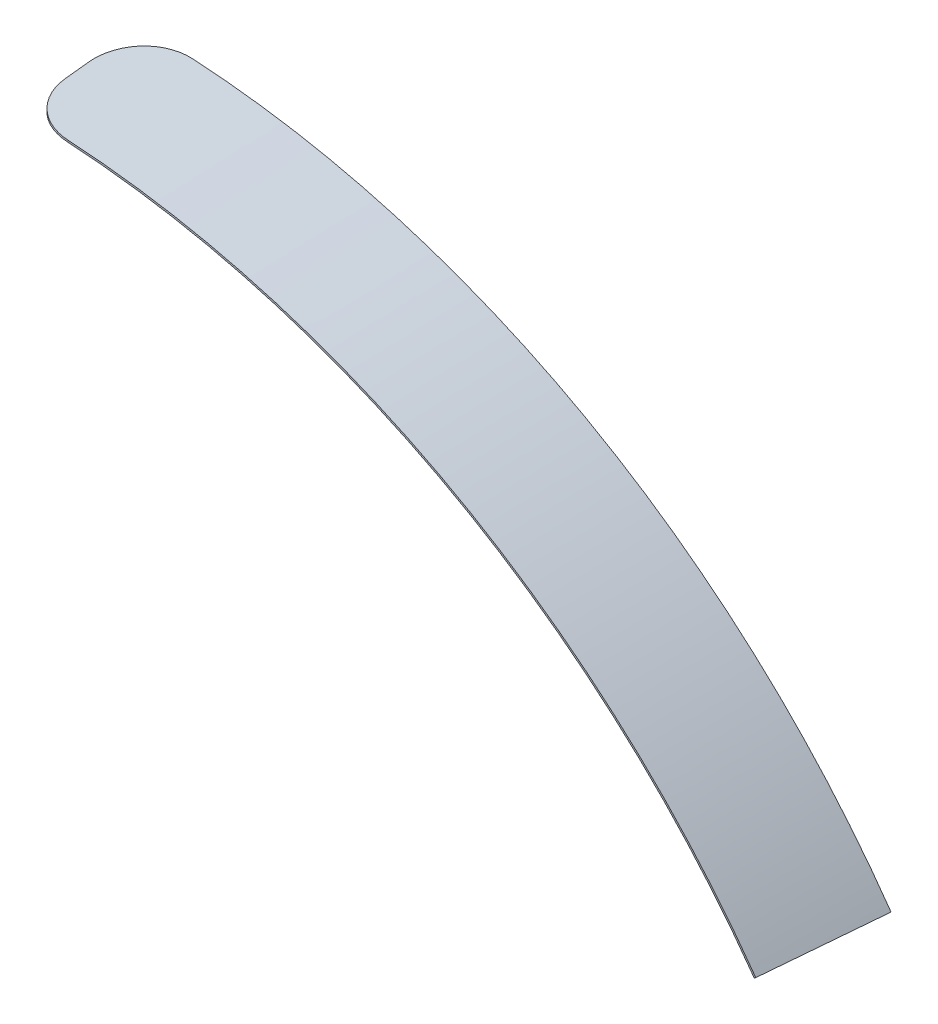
SolidWorks part; units mm, degrees
ref_plane "Plan de face" through (0, 0, 0) normal (0, 0, 1) x (1, 0, 0)
ref_plane "Plan de dessus" through (0, 0, 0) normal (0, 1, 0) x (1, 0, 0)
ref_plane "Plan de droite" through (0, 0, 0) normal (1, 0, 0) x (0, 0, -1)
sketch "Esquisse1" plane through (0, 0, 0) normal (0, 0, 1) x (1, 0, 0)
  line L0 (0, 0) -> (149.0857, 104.3909) construction
  line L1 (0, 0) -> (0, 182) construction
  arc A0 (0, 182) -> (149.0857, 104.3909) centre (0, 0) cw
  dimension "D2" = 182
  dimension "D1" = 55
extrude "Extru.-Mince1" add sketch "Esquisse1" along normal blind 25 draft 3 thin
fillet "Congé1" radius 10 2 edges at (1.3102, 180.4952, 25) (0, 180.5, 0)
